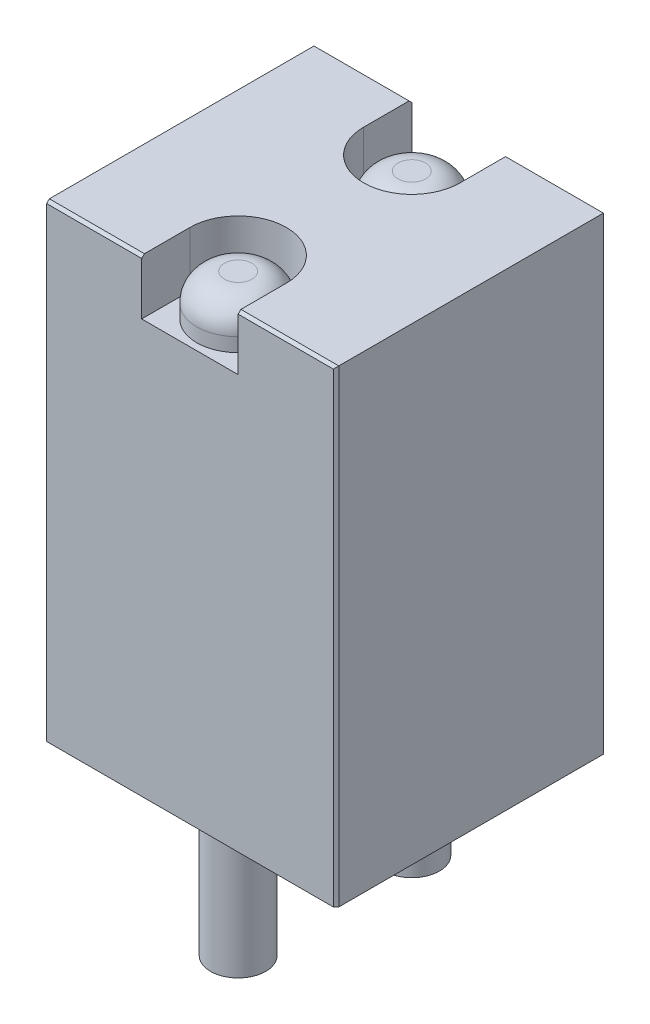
SolidWorks part; units mm, degrees
ref_plane "Plane1" through (0, 0, 0) normal (0, 0, 1) x (1, 0, 0)
ref_plane "Plane2" through (0, 0, 0) normal (0, 1, 0) x (1, 0, 0)
ref_plane "Plane3" through (0, 0, 0) normal (1, 0, 0) x (0, 0, -1)
sketch "Valve base Sketch" plane through (0, 0, 0) normal (0, 0, 1) x (1, 0, 0)
  line L0 (-10.5, 17) -> (-10.5, 0)
  line L1 (-10.5, 0) -> (0, 0)
  line L2 (0, 0) -> (0, 17)
  line L3 (-10.5, 17) -> (0, 17)
  dimension "D1" = 17
  dimension "D2" = 10.5
extrude "Valve base" add sketch "Valve base Sketch" against normal mid plane 9.8
sketch "Screw cutout Sketch" plane through (0, 17, 0) normal (0, 1, 0) x (-1, 0, 0)
  line L0 (10.5, 4.9) -> (0, 4.9) construction
  line L1 (0, 0) -> (11.6979, 0) construction
  line L2 (0, -4.9) -> (0, 4.9) construction
  line L3 (3.55, 3.15) -> (3.55, 4.9)
  line L4 (7.05, 3.15) -> (7.05, 4.9)
  line L5 (3.55, -4.9) -> (7.05, -4.9)
  line L6 (7.05, -3.15) -> (7.05, -4.9)
  line L7 (3.55, -3.15) -> (3.55, -4.9)
  line L8 (3.55, 4.9) -> (7.05, 4.9)
  line L9 (10.5, -4.9) -> (10.5, 4.9) construction
  arc A0 (3.55, 3.15) -> (7.05, 3.15) centre (5.3, 3.15) ccw
  arc A1 (3.55, -3.15) -> (7.05, -3.15) centre (5.3, -3.15) cw
  point P7 (0, 0)
  dimension "D1" = 3.5
  dimension "D2" = 5.2
  dimension "D3" = 3.15
extrude "Screw cutouts" cut sketch "Screw cutout Sketch" against normal blind 2
sketch "Mounting hole sketch" plane through (0, 15, 0) normal (0, 1, 0) x (-1, 0, 0)
  circle A0 centre (5.3, -3.15) radius 1.25
  circle A1 centre (5.3, 3.15) radius 1.25
  arc A2 (3.55, 3.15) -> (7.05, 3.15) centre (5.3, 3.15) ccw construction
  arc A4 (7.05, -3.15) -> (3.55, -3.15) centre (5.3, -3.15) ccw construction
  dimension "D1" = 2.5
extrude "Mounting holes" cut sketch "Mounting hole sketch" against normal through all
sketch "Screw head sketch" plane through (0, 15, 0) normal (0, 1, 0) x (-1, 0, 0)
  circle A0 centre (5.3, 3.15) radius 1.5
  circle A1 centre (5.3, -3.15) radius 1.5
  circle A2 centre (5.3, -3.15) radius 1.25 construction
  dimension "D1" = 3
extrude "Screw head" add sketch "Screw head sketch" along normal blind 1.5
fillet "Fillet1" radius 1
sketch "Screw threads sketch" plane through (0, 15, 0) normal (0, 1, 0) x (-1, 0, 0)
  circle A0 centre (5.3, -3.15) radius 1
  circle A1 centre (5.3, 3.15) radius 1
  circle A2 centre (5.3, -3.15) radius 1.5 construction
  dimension "D1" = 2
extrude "Screw threads" add sketch "Screw threads sketch" against normal blind 20
chamfer "Chamfer2" distance 0.1 angle 45
sketch "Manual Override point" plane through (0, 17, 0) normal (0, 1, 0) x (-1, 0, 0)
  line L2 (10.5, -4.8) -> (10.5, 4.8) construction
  point P0 (8.5, 0)
  dimension "D1" = 2
